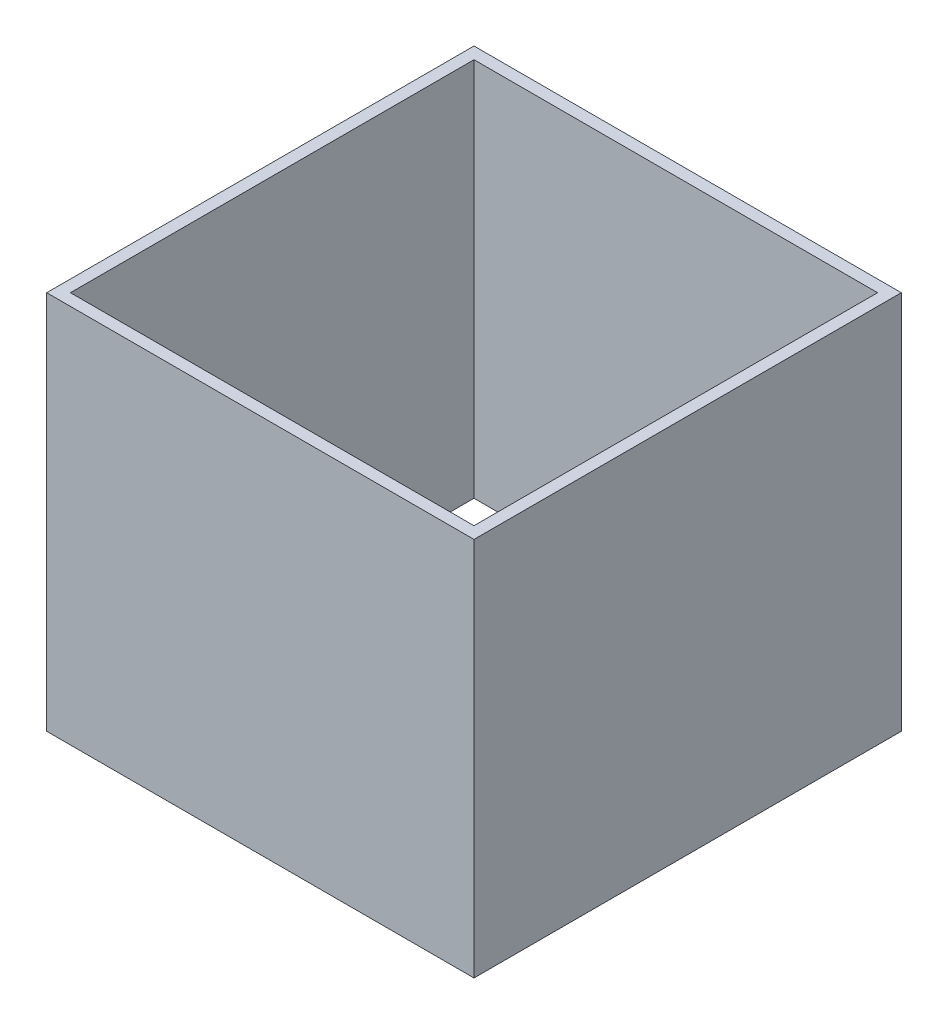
SolidWorks part; units mm, degrees
ref_plane "Front Plane" through (0, 0, 0) normal (0, 0, 1) x (1, 0, 0)
ref_plane "Top Plane" through (0, 0, 0) normal (0, 1, 0) x (1, 0, 0)
ref_plane "Right Plane" through (0, 0, 0) normal (1, 0, 0) x (0, 0, -1)
sketch "Sketch2" plane through (0, 0, 0) normal (0, 1, 0) x (1, 0, 0)
  line L1 (0, 0) -> (180, 0)
  line L2 (0, 0) -> (0, 180)
  line L3 (0, 180) -> (180, 180)
  line L4 (180, 0) -> (180, 180)
  line L5 (5, 5) -> (175, 5)
  line L6 (5, 5) -> (5, 175)
  line L7 (5, 175) -> (175, 175)
  line L8 (175, 5) -> (175, 175)
  point P9 (5, 90)
  dimension "D1" = 180
  dimension "D2" = 170
  dimension "D3" = 5
  dimension "D4" = 180
  dimension "D5" = 5
  dimension "D6" = 170
extrude "Boss-Extrude1" add sketch "Sketch2" along normal blind 160
ref_plane "Plane1" through (0, 160, 0) normal (0, 1, 0) x (1, 0, 0)
sketch "Sketch3" plane through (0, 160, 0) normal (0, 1, 0) x (1, 0, 0)
  line L0 (180, 180) -> (0, 180) construction
  line L1 (0, 0) -> (70, 0)
  line L2 (0, 0) -> (0, 180)
  line L3 (0, 180) -> (70, 180)
  line L4 (70, 0) -> (70, 180)
ref_plane "Plane2" through (0, 0, 0) normal (0, -1, 0) x (-1, 0, 0)
sketch "Sketch4" plane through (0, 0, 0) normal (0, -1, 0) x (-1, 0, 0)
  line L1 (0, 0) -> (-180, 0)
  line L2 (0, 0) -> (0, 180)
  line L3 (0, 180) -> (-180, 180)
  line L4 (-180, 0) -> (-180, 180)
